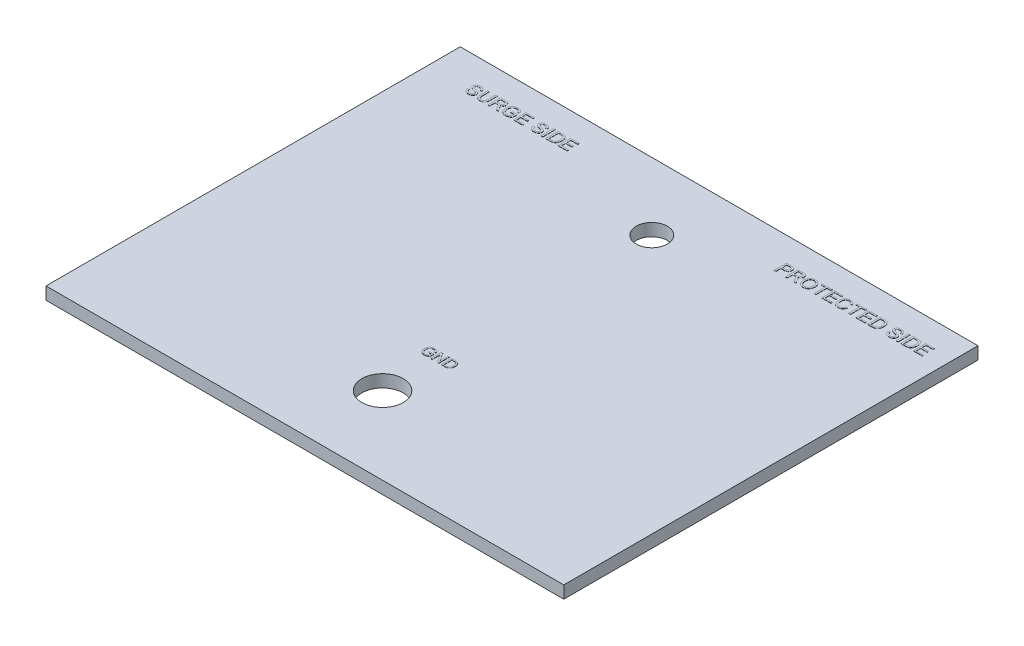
SolidWorks part; units mm, degrees
ref_plane "Front Plane" through (0, 0, 0) normal (0, 0, 1) x (1, 0, 0)
ref_plane "Top Plane" through (0, 0, 0) normal (0, 1, 0) x (1, 0, 0)
ref_plane "Right Plane" through (0, 0, 0) normal (1, 0, 0) x (0, 0, -1)
sketch "Sketch1" plane through (0, 0, 0) normal (0, 1, 0) x (1, 0, 0)
  line L0 (31.75, 31.75) -> (-31.75, 31.75)
  line L5 (-31.75, -19.05) -> (31.75, -19.05)
  line L6 (31.75, -19.05) -> (31.75, 31.75)
  line L7 (-31.75, 31.75) -> (-31.75, -19.05)
extrude "Boss-Extrude1" add sketch "Sketch1" along normal blind 1.524
sketch "Sketch2" plane through (0, 1.524, 0) normal (0, 1, 0) x (1, 0, 0)
  line L0 (0, -19.05) -> (0, -9.525) construction
  line L1 (-31.75, -19.05) -> (31.75, -19.05) construction
  line L2 (0, 31.75) -> (0, 23.495) construction
  line L3 (31.75, 31.75) -> (-31.75, 31.75) construction
  circle A1 centre (0, -9.525) radius 2.54
  circle A2 centre (0, 23.495) radius 1.905
extrude "Cut-Extrude1" cut sketch "Sketch2" against normal through all
sketch "Sketch3" plane through (0, 1.524, 0) normal (0, 1, 0) x (1, 0, 0)
  text T0 "SURGE SIDE" font "Arial" height in points 5
  text T1 "PROTECTED SIDE" font "Arial" height in points 5
  text T2 "GND" font "Arial" height in points 5
extrude "Boss-Extrude2" add sketch "Sketch3" along normal blind 0.0254
